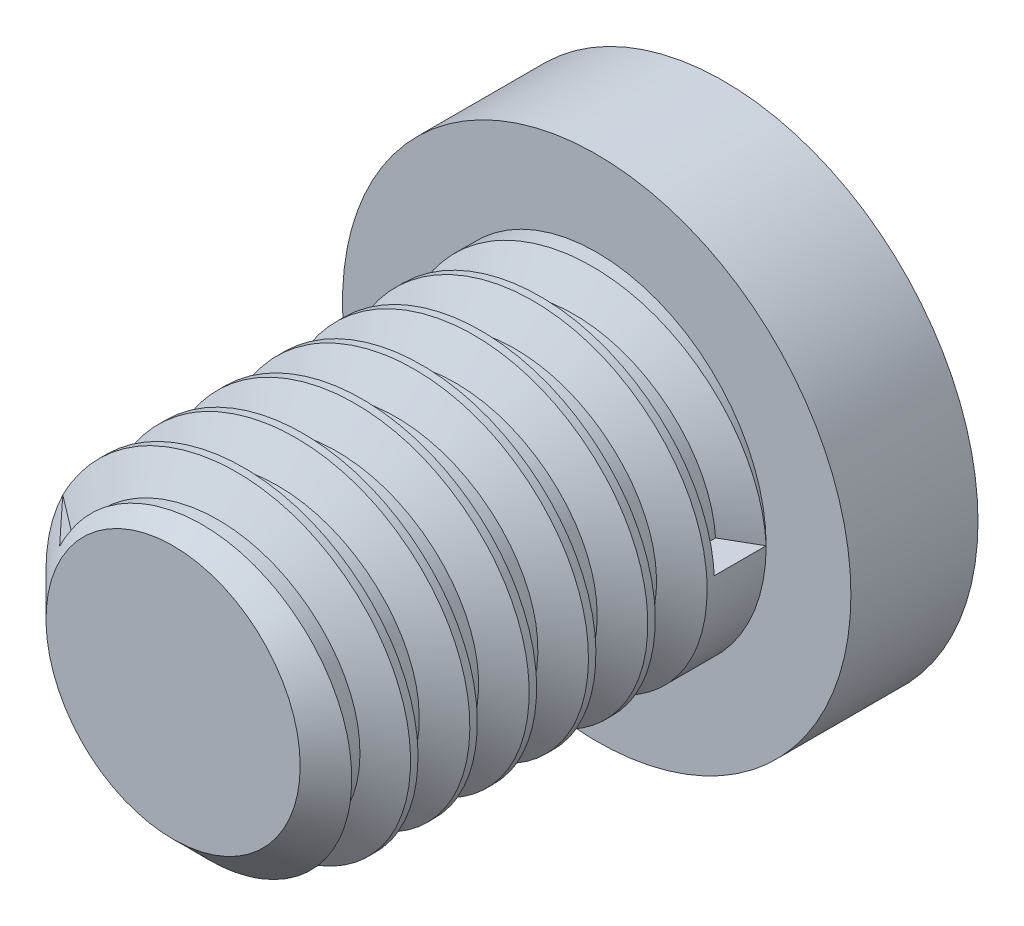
SolidWorks part; units mm, degrees
ref_plane "Front Plane" through (0, 0, 0) normal (0, 0, 1) x (1, 0, 0)
ref_plane "Top Plane" through (0, 0, 0) normal (0, 1, 0) x (1, 0, 0)
ref_plane "Right Plane" through (0, 0, 0) normal (1, 0, 0) x (0, 0, -1)
sketch "Sketch1" plane through (0, 0, 0) normal (0, 0, 1) x (1, 0, 0)
  circle A0 centre (0, 0) radius 2
  dimension "D1" = 4
sketch "Sketch2" plane through (0, 0, 0) normal (0, 0, 1) x (1, 0, 0)
  circle A0 centre (0, 0) radius 3
  dimension "D1" = 6
extrude "Boss-Extrude1" add sketch "Sketch1" along normal blind 5
extrude "Boss-Extrude2" add sketch "Sketch2" against normal blind 1.5
chamfer "Chamfer1" distance 0.5 angle 45 1 edges at (2, 0, 5)
thread "Thread2" pitch 0.7 start angle 0, offset 0, length 0, pitch 0.7, diameter 4
ref_plane "Plane3" through (2, 0, 0) normal (0, -1, 0) x (1, 0, 0)
sketch "Thread Profile3" plane through (2, 0, 0) normal (0, -1, 0) x (1, 0, 0)
  line L0 (0, 0) -> (0, 0.7) construction
  line L11 (0, 0) -> (0, 0.6125)
  line L12 (0, 0.6125) -> (-0.3789, 0.3937)
  line L13 (-0.3789, 0.3937) -> (-0.3789, 0.2187)
  line L15 (-0.3789, 0.2187) -> (0, 0)
  line L17 (-0.3789, 0.3062) -> (0, 0.3062) construction
  point P2 (0, 0)
  dimension "Pitch" = 0.7
  dimension "Profile_Angle" = 60
  dimension "Profile_Land" = 0.175
  dimension "Profile_Height" = 0.3789
sketch "Sketch12" plane through (0, 0, -1.5) normal (0, 0, -1) x (-1, 0, 0)
  line L1 (0.75, -2) -> (-0.75, -2)
  line L2 (0.75, -2) -> (0.75, 2)
  line L3 (0.75, 2) -> (-0.75, 2)
  line L4 (-0.75, -2) -> (-0.75, 2)
  line L5 (0.75, -2) -> (-0.75, 2) construction
  line L6 (0.75, 2) -> (-0.75, -2) construction
  point P0 (0, 0)
  dimension "D1" = 1.5
  dimension "D2" = 4
extrude "Cut-Extrude1" cut sketch "Sketch12" against normal blind 0.75
chamfer "Chamfer3" distance 0.6 distance2 0.75 2 edges at (0, -2, -1.5) (0, 2, -1.5)
pattern_circular "CirPattern2" count 2 every 90 about axis through (0, 0, 0) along (0, 0, 1) of "Cut-Extrude1", "Chamfer3"
